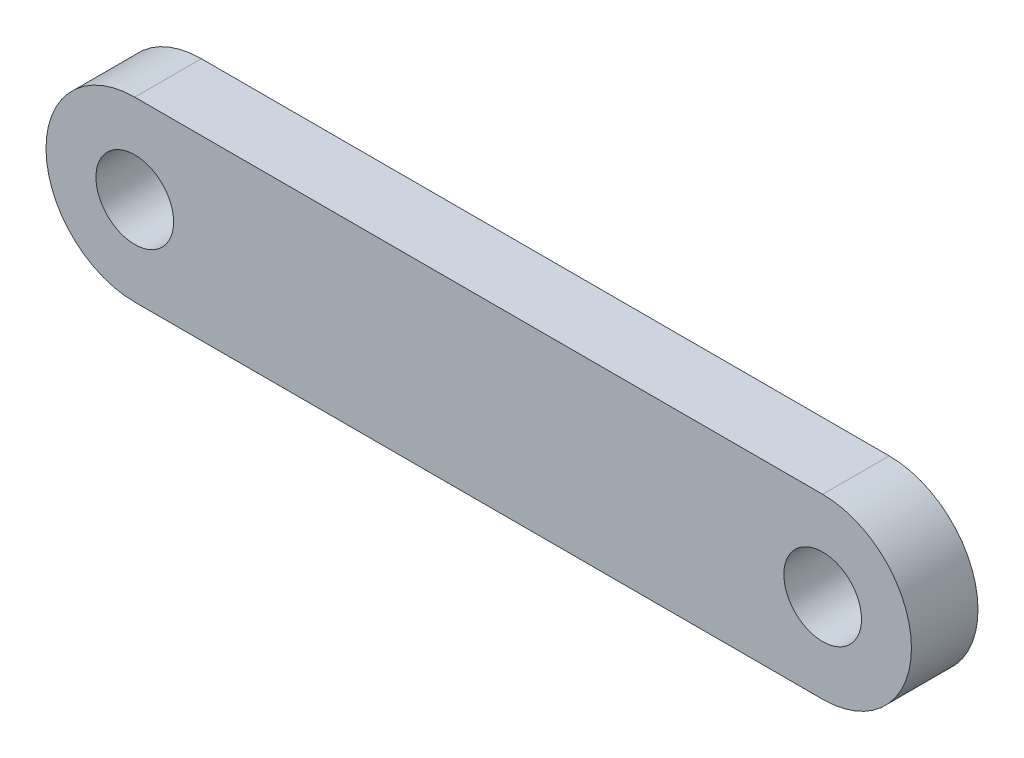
SolidWorks part; units mm, degrees
ref_plane "前视基准面" through (0, 0, 0) normal (0, 0, 1) x (1, 0, 0)
ref_plane "上视基准面" through (0, 0, 0) normal (0, 1, 0) x (1, 0, 0)
ref_plane "右视基准面" through (0, 0, 0) normal (1, 0, 0) x (0, 0, -1)
sketch "草图1" plane through (0, 0, 0) normal (0, 0, 1) x (1, 0, 0)
  line L0 (0, 0) -> (31, 0) construction
  line L1 (0, 4) -> (31, 4)
  line L2 (0, -4) -> (31, -4)
  arc A0 (0, 4) -> (0, -4) centre (0, 0) ccw
  arc A1 (31, -4) -> (31, 4) centre (31, 0) ccw
  circle A2 centre (0, 0) radius 1.75
  circle A3 centre (31, 0) radius 1.75
  point P3 (15.5, 0)
  dimension "D1" = 3.5
  dimension "D2" = 3.5
  dimension "D4" = 4
  dimension "D3" = 31
extrude "凸台-拉伸1" add sketch "草图1" along normal blind 3
equation "\"Dummy1\"= \"零件图号代码\""
equation "\"Dummy2\"= \"产品名称代码\""
